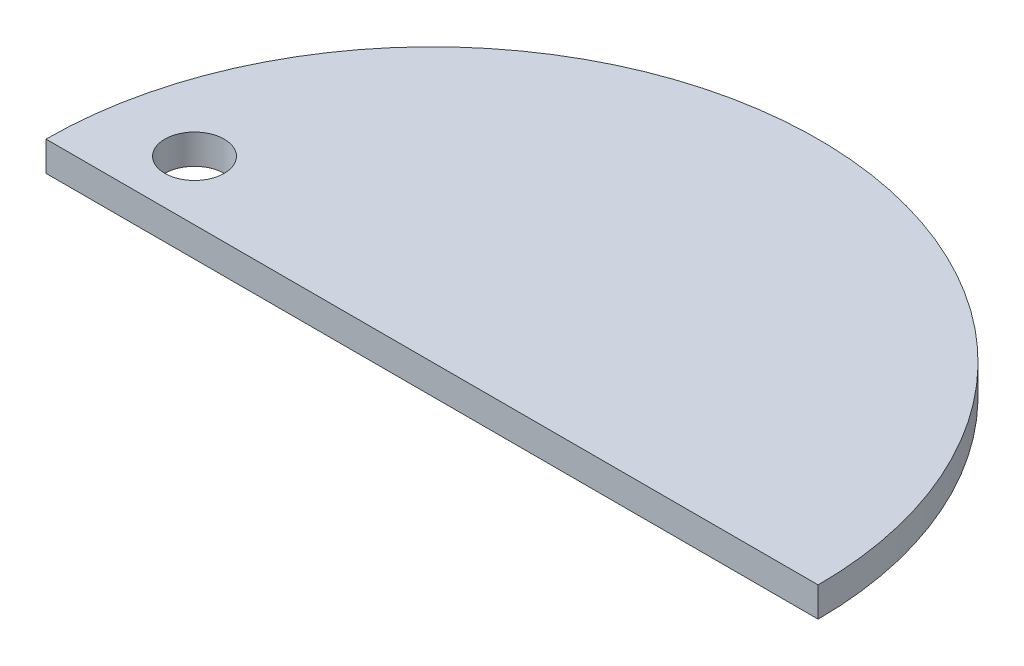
SolidWorks part; units mm, degrees
ref_plane "Front Plane" through (0, 0, 0) normal (0, 0, 1) x (1, 0, 0)
ref_plane "Top Plane" through (0, 0, 0) normal (0, 1, 0) x (1, 0, 0)
ref_plane "Right Plane" through (0, 0, 0) normal (1, 0, 0) x (0, 0, -1)
sketch "Sketch1" plane through (0, 0, 0) normal (0, 1, 0) x (1, 0, 0)
  line L1 (75, 50) -> (-75, 50)
  line L2 (75, 50) -> (75, -50)
  line L3 (75, -50) -> (-75, -50)
  line L4 (-75, 50) -> (-75, -50)
  line L5 (75, 50) -> (-75, -50) construction
  line L6 (75, -50) -> (-75, 50) construction
  circle A0 centre (-60, -40) radius 5
  arc A1 (-75, -50) -> (55, -50) centre (-10, -50) cw
  point P0 (0, 0)
  dimension "D3" = 10
  dimension "D4" = 10
  dimension "D5" = 5
  dimension "D6" = 65
  dimension "D1" = 100
  dimension "D2" = 150
extrude "Boss-Extrude2" add sketch "Sketch1" along normal blind 5 contours A1 L3 A0
